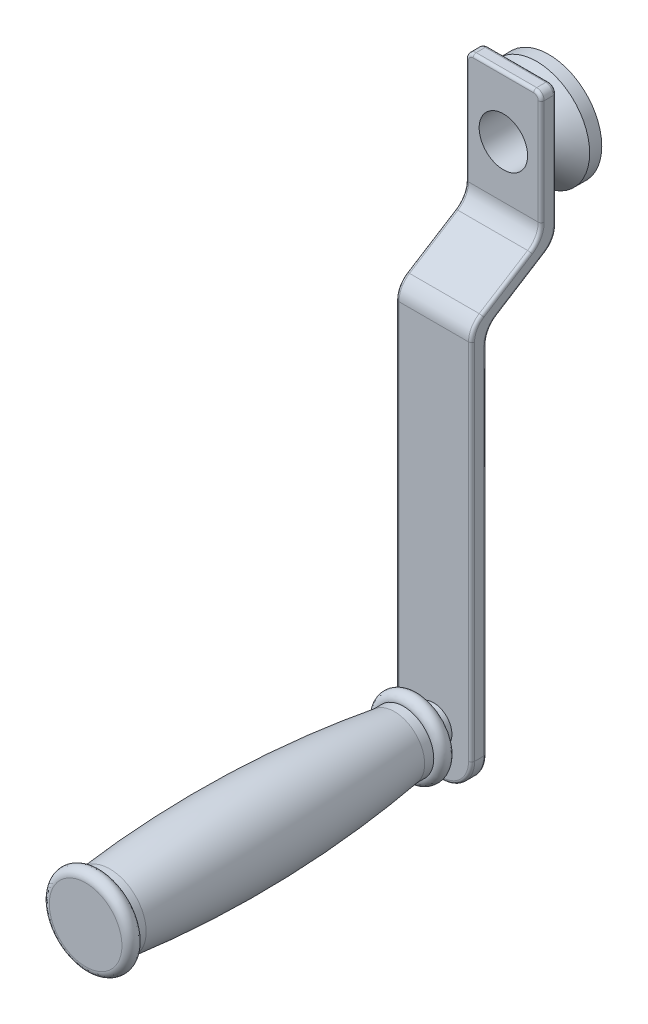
SolidWorks part; units mm, degrees
ref_plane "Plan de face" through (0, 0, 0) normal (0, 0, 1) x (1, 0, 0)
ref_plane "Plan de dessus" through (0, 0, 0) normal (0, 1, 0) x (1, 0, 0)
ref_plane "Plan de droite" through (0, 0, 0) normal (1, 0, 0) x (0, 0, -1)
ref_plane "Plan1" through (-12.5, 0, 0) normal (-1, 0, 0) x (0, -1, 0)
sketch "Esquisse1" plane through (-12.5, 0, 0) normal (-1, 0, 0) x (0, -1, 0)
  line L0 (0, 0) -> (-190, 0)
  line L1 (-190, 0) -> (-190, -28)
  line L2 (-190, -28) -> (0, -28)
  line L3 (0, -28) -> (0, 0)
extrude "Boss.-Extru.1" add sketch "Esquisse1" against normal blind 25
sketch "Esquisse2" plane through (12.5, 0, 0) normal (1, 0, 0) x (0, 0, -1)
  line L0 (23, 134.141) -> (23, 190)
  line L1 (23, 190) -> (0, 190)
  line L2 (0, 190) -> (0, 134.141)
  line L3 (0, 134.141) -> (23, 134.141)
extrude "Enlèv. mat.-Extru.1" cut sketch "Esquisse2" against normal through all
sketch "Esquisse3" plane through (12.5, 0, 0) normal (1, 0, 0) x (0, 0, -1)
  line L0 (28, 131.3803) -> (5, 131.3803)
  line L1 (5, 131.3803) -> (5, 0)
  line L2 (5, 0) -> (28, 0)
  line L3 (28, 0) -> (28, 131.3803)
extrude "Enlèv. mat.-Extru.2" cut sketch "Esquisse3" against normal through all
draft "Dépouille1" type of draft neutral plane draft angle 32.191 faces to draft 1 parameters "D1"=32.191
draft "Dépouille2" type of draft neutral plane draft angle 32.191 faces to draft 1 parameters "D1"=32.191
ref_plane "Plan2" through (0, 15, 0) normal (0, 1, 0) x (1, 0, 0)
sketch "Esquisse4" plane through (0, 15, 0) normal (0, 1, 0) x (1, 0, 0)
  line L0 (6, 0) -> (0, 0)
  line L1 (0, 0) -> (0, -115)
  line L2 (0, -115) -> (12, -115)
  line L3 (12, -110) -> (12, -107)
  line L4 (10, -13) -> (10, -10)
  line L5 (10, -5) -> (6, -5)
  line L6 (6, -5) -> (6, 0)
  line L7 (0, 0) -> (0, -115.141) construction
  arc A0 (12, -107) -> (10, -13) centre (-366.5904, -68.0338) ccw
  spline S0 degree 3 poles (12, -110) (12.2798, -110) (12.5635, -110.0483) (12.8275, -110.1409) (13.0916, -110.2335) (13.3432, -110.373) (13.5617, -110.5478) (13.7802, -110.7226) (13.9716, -110.9375) (14.1199, -111.1748) (14.2682, -111.4121) (14.3776, -111.6782) (14.439, -111.9512) (14.5004, -112.2242) (14.5156, -112.5115) (14.4832, -112.7895) (14.4508, -113.0674) (14.37, -113.3436) (14.2474, -113.5951) (14.1248, -113.8466) (13.9571, -114.0805) (13.7582, -114.2773) (13.5593, -114.4741) (13.3237, -114.6392) (13.0708, -114.7591) (12.818, -114.8789) (12.541, -114.9568) (12.2627, -114.9862) (12.1755, -114.9954) (12.0877, -115) (12, -115) knots 0 0 0 0 0.000839 0.000839 0.000839 0.001679 0.001679 0.001679 0.002518 0.002518 0.002518 0.003358 0.003358 0.003358 0.004197 0.004197 0.004197 0.005037 0.005037 0.005037 0.005876 0.005876 0.005876 0.006715 0.006715 0.006715 0.007555 0.007555 0.007555 0.007815 0.007815 0.007815 0.007815
  spline S1 degree 3 poles (10, -5) (10.2798, -5) (10.5635, -5.0483) (10.8275, -5.1409) (11.0916, -5.2335) (11.3432, -5.373) (11.5617, -5.5478) (11.7802, -5.7226) (11.9716, -5.9375) (12.1199, -6.1748) (12.2682, -6.4121) (12.3776, -6.6782) (12.439, -6.9512) (12.5004, -7.2242) (12.5156, -7.5115) (12.4832, -7.7895) (12.4508, -8.0674) (12.37, -8.3436) (12.2474, -8.5951) (12.1248, -8.8466) (11.9571, -9.0805) (11.7582, -9.2773) (11.5593, -9.4741) (11.3237, -9.6392) (11.0708, -9.7591) (10.818, -9.8789) (10.541, -9.9568) (10.2627, -9.9862) (10.1755, -9.9954) (10.0877, -10) (10, -10) knots 0 0 0 0 0.000839 0.000839 0.000839 0.001679 0.001679 0.001679 0.002518 0.002518 0.002518 0.003358 0.003358 0.003358 0.004197 0.004197 0.004197 0.005037 0.005037 0.005037 0.005876 0.005876 0.005876 0.006715 0.006715 0.006715 0.007555 0.007555 0.007555 0.007815 0.007815 0.007815 0.007815
revolve "Révolution1" add sketch "Esquisse4" angle 360 about L7
ref_plane "Plan3" through (0, 15, 0) normal (0, -1, 0) x (1, 0, 0)
sketch "Esquisse5" plane through (0, 15, 0) normal (0, -1, 0) x (1, 0, 0)
  line L0 (8, -5) -> (0, -5)
  line L1 (0, -5) -> (0, -7)
  line L2 (0, -7) -> (8, -7)
  line L3 (8, -7) -> (8, -5)
  line L4 (0, -5) -> (0, -7) construction
revolve "Révolution2" add sketch "Esquisse5" angle 360 about L4
ref_plane "Plan4" through (0, 170, 0) normal (0, 1, 0) x (1, 0, 0)
sketch "Esquisse6" plane through (0, 170, 0) normal (0, 1, 0) x (1, 0, 0)
  line L0 (17.5, 38) -> (0, 38)
  line L1 (0, 38) -> (0, 28)
  line L2 (0, 28) -> (10, 28)
  line L3 (10, 28) -> (17.5, 34)
  line L4 (17.5, 34) -> (17.5, 38)
  line L5 (0, 38) -> (0, 28) construction
revolve "Révolution3" add sketch "Esquisse6" angle 360 about L5
hole_wizard "Diamètre du perçage Ø16.0 (16)1" positions "Esquisse8" profile "Esquisse7" hole size "Ø16.0" standard "Ansi Metric"
sketch "Esquisse8" plane through (0, 0, -23) normal (0, 0, 1) x (1, 0, 0)
  point P0 (0, 170)
sketch "Esquisse7" plane through (0, 170, -23) normal (1, 0, 0) x (0, -1, 0)
  line L0 (0, 0) -> (0, 15)
  line L1 (0, 15) -> (8, 15)
  line L2 (8, 15) -> (8, 0)
  line L5 (8, 0) -> (0, 0)
  line L11 (0, -6.35) -> (0, 107.95) construction
  dimension "Diamètre du perçage jusqu'au prochain" = 16
  dimension "Profondeur du perçage jusqu'au prochain" = 15
fillet "Congé1" radius 2.5 2 edges at (12.5, 190, -25.5) (-12.5, 190, -25.5)
fillet "Congé2" radius 7.5 4 edges at (0, 148.6197, -23) (0, 131.3803, -5) (0, 145.859, -28) (0, 134.141, 0)
fillet "Congé3" radius 10 2 edges at (-12.5, 0, -2.5) (12.5, 0, -2.5)
fillet "Congé4" radius 1 32 edges at (-9.5711, 2.9289, -5) (0, 0, -5) (-12.5, 68.6197, -5) (9.5711, 2.9289, -5) (-12.5, 130.8645, -5.9343) (12.5, 68.6197, -5) (-12.5, 138.6197, -16.5) (12.5, 130.8645, -5.9343) (-12.5, 146.3748, -27.0657) (12.5, 138.6197, -16.5) (-12.5, 168.75, -28) (12.5, 146.3748, -27.0657) (-11.7678, 189.2678, -28) (12.5, 168.75, -28) (0, 190, -28) (11.7678, 189.2678, -28) (-9.5711, 2.9289, 0) (-12.5, 70, 0) (0, 0, 0) (-12.5, 133.6252, -0.9343) (9.5711, 2.9289, 0) (-12.5, 141.3803, -11.5) (12.5, 70, 0) (-12.5, 149.1355, -22.0657) (12.5, 133.6252, -0.9343) (-12.5, 170.1303, -23) (12.5, 141.3803, -11.5) (-11.7678, 189.2678, -23) (12.5, 149.1355, -22.0657) (0, 190, -23) (12.5, 170.1303, -23) (11.7678, 189.2678, -23)
